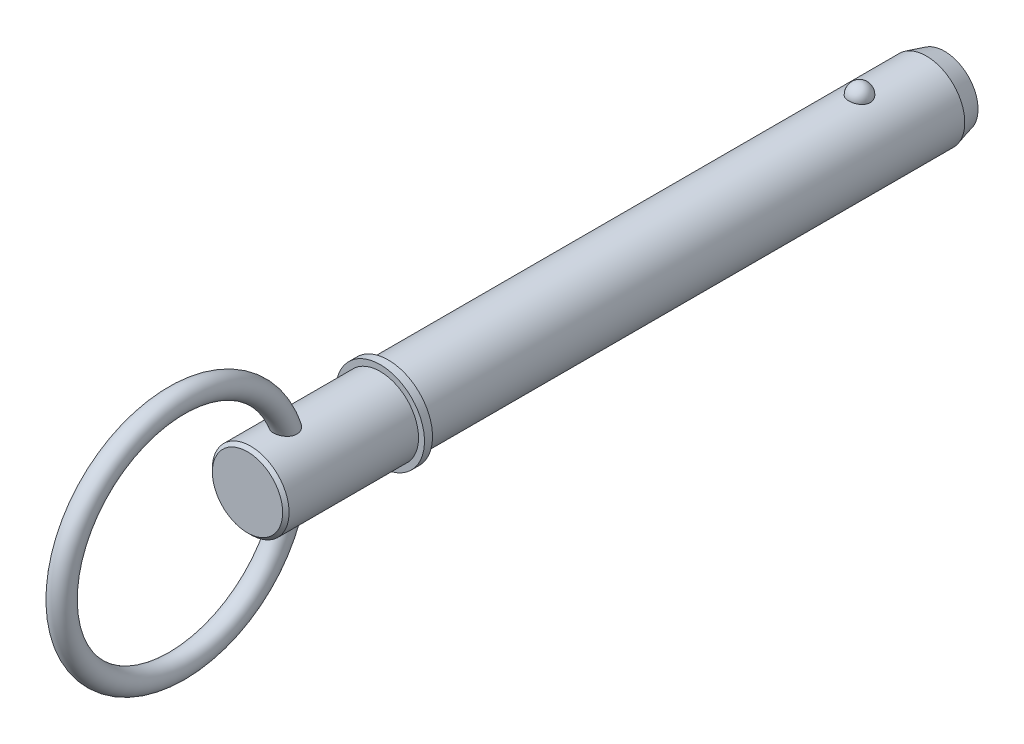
SolidWorks part; units mm, degrees
ref_plane "Front Plane" through (0, 0, 0) normal (0, 0, 1) x (1, 0, 0)
ref_plane "Top Plane" through (0, 0, 0) normal (0, 1, 0) x (1, 0, 0)
ref_plane "Right Plane" through (0, 0, 0) normal (1, 0, 0) x (0, 0, -1)
sketch "Sketch2" plane through (0, 0, 0) normal (0, 0, 1) x (1, 0, 0)
  circle A0 centre (0, 0) radius 9.525
  point P3 (0, 9.525)
  dimension "D1" = 19.05
extrude "Boss-Extrude1" add sketch "Sketch2" along normal blind 114.3
sketch "Sketch3" plane through (0, 0, 0) normal (0, 0, -1) x (-1, 0, 0)
  circle A0 centre (0, 0) radius 9.525
  dimension "D1" = 19.05
extrude "Boss-Extrude2" add sketch "Sketch3" along normal blind 23.8
chamfer "Chamfer1" distance 4.5 angle 15 1 edges at (-9.525, 0, -23.8)
sketch "Sketch18" plane through (0, 0, 0) normal (1, 0, 0) x (0, 0, -1)
  line L0 (19.3, 9.525) -> (-114.3, 9.525) construction
  line L1 (2.69, 12.215) -> (2.69, 6.835)
  line L2 (-114.3, -9.525) -> (19.3, -9.525) construction
  arc A0 (2.69, 12.215) -> (2.69, 6.835) centre (2.69, 9.525) ccw
  point P4 (0, 9.525)
  dimension "D1" = 21.74
revolve "Revolve1" add sketch "Sketch18" angle 360 about L1
sketch "Sketch19" plane through (0, 0, 0) normal (1, 0, 0) x (0, 0, -1)
  line L0 (-33.7288, 0) -> (-46.4542, 0) construction
sketch "Sketch20" plane through (0, 0, 0) normal (1, 0, 0) x (0, 0, -1)
  line L0 (-114.3, 0) -> (-114.3, 11)
  line L1 (-114.3, 9.525) -> (-114.3, -9.525) construction
  line L2 (-114.3, 11) -> (-116.3, 11)
  line L3 (-116.3, 11) -> (-116.3, 0)
  line L4 (-33.7288, 0) -> (-46.4542, 0) construction
  line L5 (-116.3, 0) -> (-114.3, 0)
  dimension "D1" = 11
  dimension "D2" = 2
revolve "Revolve2" add sketch "Sketch20" angle 360 about L0
sketch "Sketch21" plane through (0, 0, 114.3) normal (0, 0, -1) x (-1, 0, 0)
  circle A0 centre (0, 0) radius 9.525
  dimension "D1" = 19.05
extrude "Boss-Extrude3" add sketch "Sketch21" against normal blind 34.93
chamfer "Chamfer2" distance 0.8 angle 45 1 edges at (-9.525, 0, 149.23)
sketch "Sketch23" plane through (0, 0, 0) normal (1, 0, 0) x (0, 0, -1)
  line L0 (-149.23, 8.725) -> (-149.23, -8.725) construction
  circle A0 centre (-166.805, 0) radius 28.575
  point P2 (-138.23, 0)
  dimension "D1" = 57.15
  dimension "D2" = 11
sketch "Sketch24" plane through (0, 0, 0) normal (0, 1, 0) x (1, 0, 0)
  circle A0 centre (0, -138.23) radius 2.75
  dimension "D1" = 5.5
sweep "Sweep1" add profiles "Sketch24" path "Sketch23"
